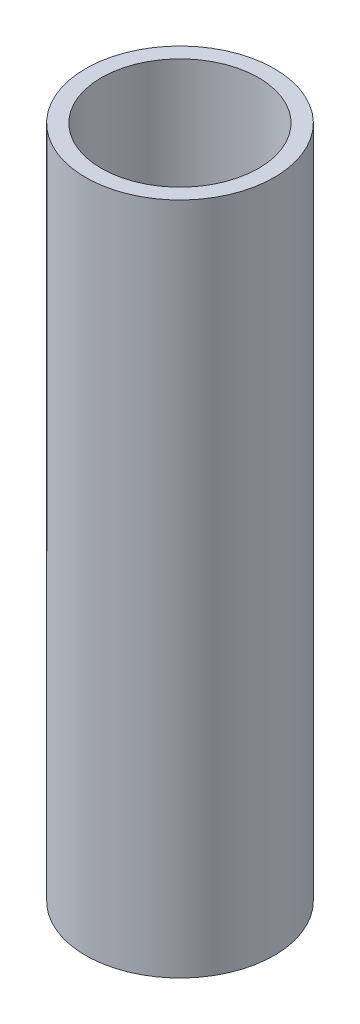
SolidWorks part; units mm, degrees
ref_plane "Front" through (0, 0, 0) normal (0, 0, 1) x (1, 0, 0)
ref_plane "Top" through (0, 0, 0) normal (0, 1, 0) x (1, 0, 0)
ref_plane "Right" through (0, 0, 0) normal (1, 0, 0) x (0, 0, -1)
sketch "草图1" plane through (0, 0, 0) normal (0, 1, 0) x (1, 0, 0)
  circle A0 centre (0, 0) radius 12.6
  circle A1 centre (0, 0) radius 10.5
  dimension "D1" = 25.2
  dimension "D2" = 21
extrude "凸台-拉伸1" add sketch "草图1" along normal blind 90
